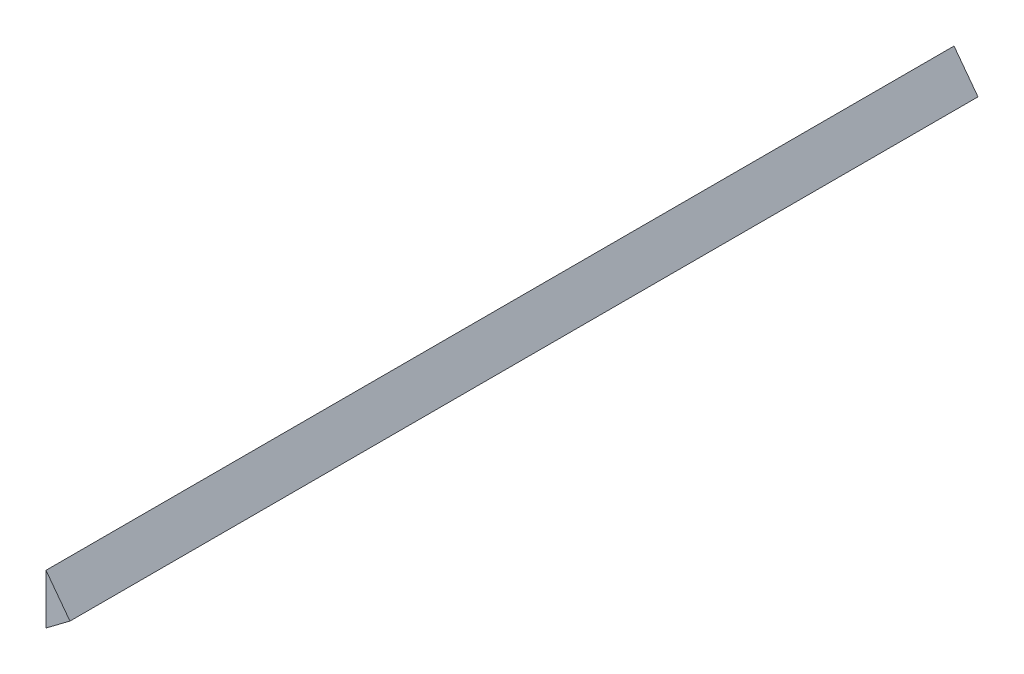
SolidWorks part; units mm, degrees
ref_plane "Front Plane" through (0, 0, 0) normal (0, 0, 1) x (1, 0, 0)
ref_plane "Top Plane" through (0, 0, 0) normal (0, 1, 0) x (1, 0, 0)
ref_plane "Right Plane" through (0, 0, 0) normal (1, 0, 0) x (0, 0, -1)
sketch "Sketch1" plane through (0, 0, 0) normal (0, 0, 1) x (1, 0, 0)
  line L0 (0, -2290.4465) -> (30.506, -2267.6212)
  line L1 (30.506, -2267.6212) -> (0, -2226.8501)
  line L2 (0, -2538.8773) -> (0, -2060.7883) construction
  line L3 (0, -2226.8501) -> (0, -2290.4465)
extrude "Boss-Extrude1" add sketch "Sketch1" against normal up to vertex (1155.7 mm away)
